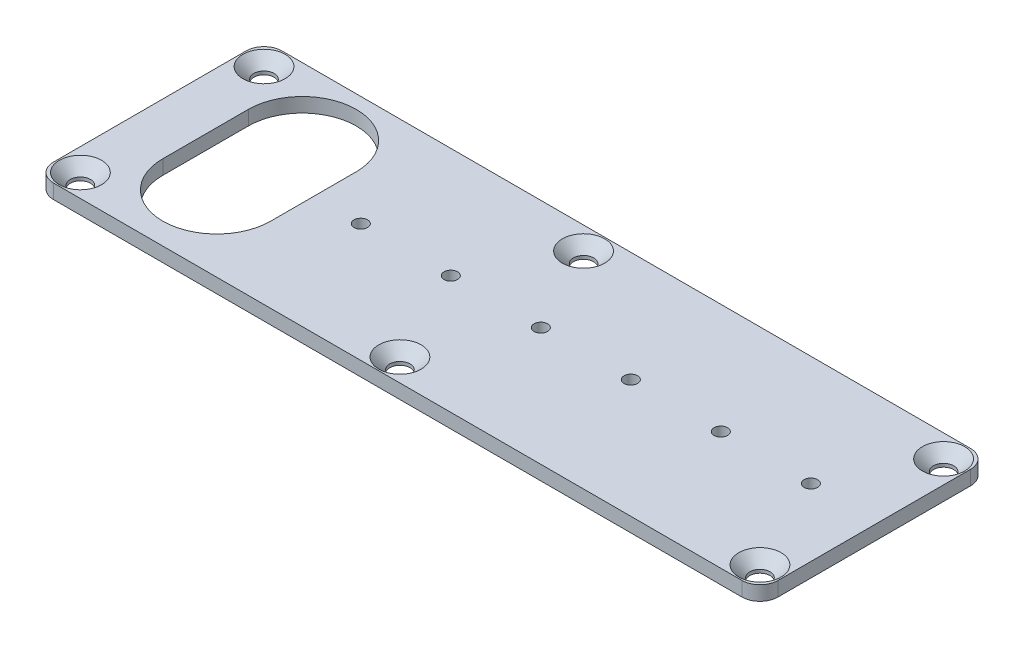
SolidWorks part; units mm, degrees
ref_plane "Front Plane" through (0, 0, 0) normal (0, 0, 1) x (1, 0, 0)
ref_plane "Top Plane" through (0, 0, 0) normal (0, 1, 0) x (1, 0, 0)
ref_plane "Right Plane" through (0, 0, 0) normal (1, 0, 0) x (0, 0, -1)
sketch "Sketch1" plane through (0, 0, 0) normal (0, 1, 0) x (1, 0, 0)
  line L1 (0, 0) -> (161, 0)
  line L2 (0, 0) -> (0, 50.8)
  line L3 (0, 50.8) -> (161, 50.8)
  line L4 (161, 0) -> (161, 50.8)
  dimension "D1" = 50.8
  dimension "D2" = 161
extrude "Boss-Extrude1" add sketch "Sketch1" along normal blind 3.2
sketch "Sketch2" plane through (0, 3.2, 0) normal (0, 1, 0) x (1, 0, 0)
  line L0 (161, 0) -> (161, 50.8) construction
  line L1 (23.5, 35.8) -> (23.5, 16.8) construction
  line L2 (161, 50.8) -> (0, 50.8) construction
  line L3 (35.5, 35.8) -> (35.5, 16.8)
  line L4 (11.5, 35.8) -> (11.5, 16.8)
  circle A0 centre (146, 26.3) radius 1.5
  circle A1 centre (126, 26.3) radius 1.5
  circle A2 centre (106, 26.3) radius 1.5
  circle A3 centre (86, 26.3) radius 1.5
  circle A4 centre (66, 26.3) radius 1.5
  circle A5 centre (46, 26.3) radius 1.5
  arc A6 (35.5, 35.8) -> (11.5, 35.8) centre (23.5, 35.8) ccw
  arc A7 (11.5, 16.8) -> (35.5, 16.8) centre (23.5, 16.8) ccw
  point P18 (23.5, 26.3)
  dimension "D1" = 3
  dimension "D2" = 15
  dimension "D3" = 24.5
  dimension "D4" = 20
  dimension "D5" = 20
  dimension "D6" = 20
  dimension "D7" = 20
  dimension "D8" = 20
  dimension "D9" = 24.5
  dimension "D10" = 24.5
  dimension "D11" = 24.5
  dimension "D12" = 24.5
  dimension "D13" = 24.5
  dimension "D14" = 149.5
  dimension "D15" = 125.5
  dimension "D16" = 19
  dimension "D17" = 15
extrude "Cut-Extrude2" cut sketch "Sketch2" against normal through all
fillet "Fillet1" radius 4 4 edges at (161, 1.6, 0) (0, 1.6, 0) (0, 1.6, -50.8) (161, 1.6, -50.8)
hole_wizard "CSK for M4 Flat Head Machine Screw1" positions "Sketch4" profile "Sketch3" countersink size "M4" standard "ANSI Metric"
sketch "Sketch4" plane through (0, 3.2, 0) normal (0, 1, 0) x (1, 0, 0)
  point P0 (156, 5)
  point P3 (76, 5)
  point P6 (5, 5)
  point P9 (5, 45.8)
  point P12 (76, 45.8)
  point P15 (156, 45.8)
sketch "Sketch3" plane through (156, 3.2, -5) normal (1, 0, 0) x (0, 0, 1)
  line L0 (0, 0) -> (0, 6.3519)
  line L1 (0, 6.3519) -> (2.25, 5)
  line L2 (2.25, 5) -> (2.25, 2.45)
  line L3 (2.25, 2.45) -> (4.7, 0)
  line L5 (4.7, 0) -> (0, 0)
  line L6 (-2.25, 2.45) -> (-4.7, 0) construction
  line L10 (0, 6.3519) -> (-2.25, 5) construction
  line L11 (0, -6.35) -> (0, 107.95) construction
  dimension "Hole Dia." = 4.5
  dimension "Hole Depth" = 5
  dimension "Near C'Sink Dia." = 9.4
  dimension "Near C'Sink Angle" = 90
  dimension "Drill Angle" = 118
